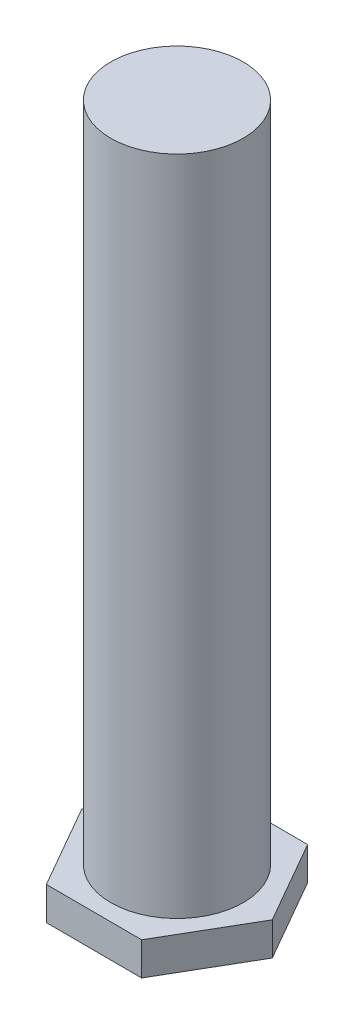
SolidWorks part; units mm, degrees
ref_plane "Front Plane" through (0, 0, 0) normal (0, 0, 1) x (1, 0, 0)
ref_plane "Top Plane" through (0, 0, 0) normal (0, 1, 0) x (1, 0, 0)
ref_plane "Right Plane" through (0, 0, 0) normal (1, 0, 0) x (0, 0, -1)
sketch "Sketch1" plane through (0, 0, 0) normal (0, 1, 0) x (1, 0, 0)
  line L1 (2.8713, -5.0089) -> (5.7735, -0.0178)
  line L2 (5.7735, -0.0178) -> (2.9021, 4.9911)
  line L3 (2.9021, 4.9911) -> (-2.8713, 5.0089)
  line L4 (-2.8713, 5.0089) -> (-5.7735, 0.0178)
  line L5 (-5.7735, 0.0178) -> (-2.9021, -4.9911)
  line L6 (-2.9021, -4.9911) -> (2.8713, -5.0089)
  circle A0 centre (0, 0) radius 5 construction
extrude "Boss-Extrude1" add sketch "Sketch1" along normal blind 2
sketch "Sketch2" plane through (0, 2, 0) normal (0, 1, 0) x (1, 0, 0)
  circle A0 centre (0, 0) radius 4
extrude "Boss-Extrude2" add sketch "Sketch2" along normal blind 40
